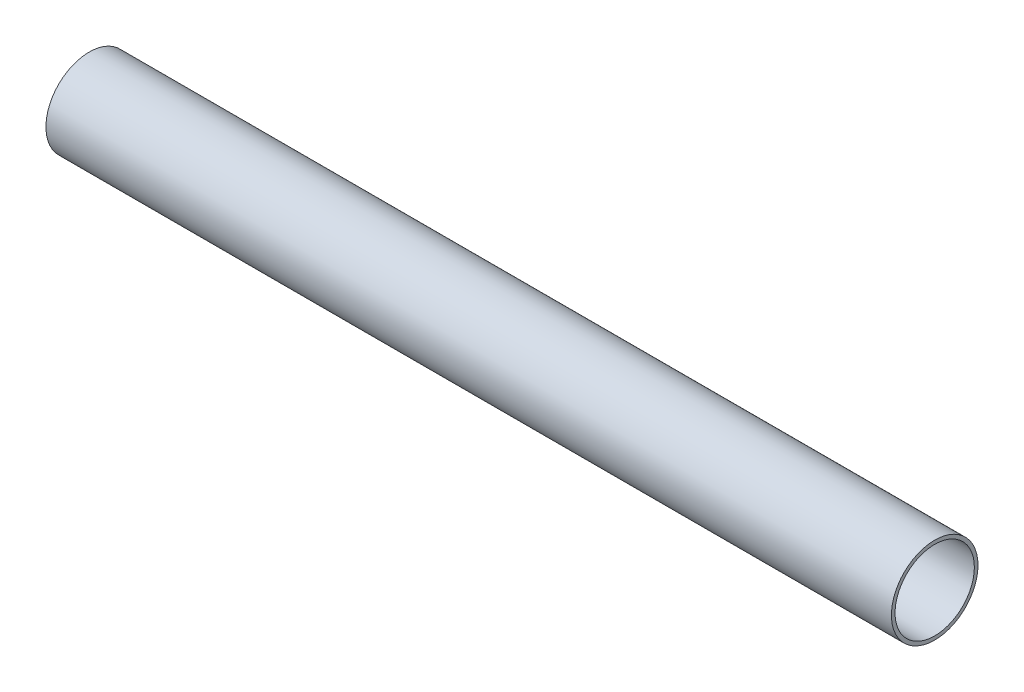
SolidWorks part; units mm, degrees
ref_plane "Plan de face" through (0, 0, 0) normal (0, 0, 1) x (1, 0, 0)
ref_plane "Plan de dessus" through (0, 0, 0) normal (0, 1, 0) x (1, 0, 0)
ref_plane "Plan de droite" through (0, 0, 0) normal (1, 0, 0) x (0, 0, -1)
sketch "Esquisse1" plane through (0, 0, 0) normal (0, 0, 1) x (1, 0, 0)
  line L0 (0, 0) -> (743, 0)
  dimension "D1" = 743
ref_plane "Plan1" through (743, 0, 0) normal (1, 0, 0) x (0, 0, -1)
sketch "Esquisse2" plane through (743, 0, 0) normal (1, 0, 0) x (0, 0, -1)
  circle A0 centre (0, 0) radius 34.85
  dimension "D1" = 69.7
sweep "Balayage-Mince3" add profiles "Esquisse2" path "Esquisse1" parameters "D1"=3.2
